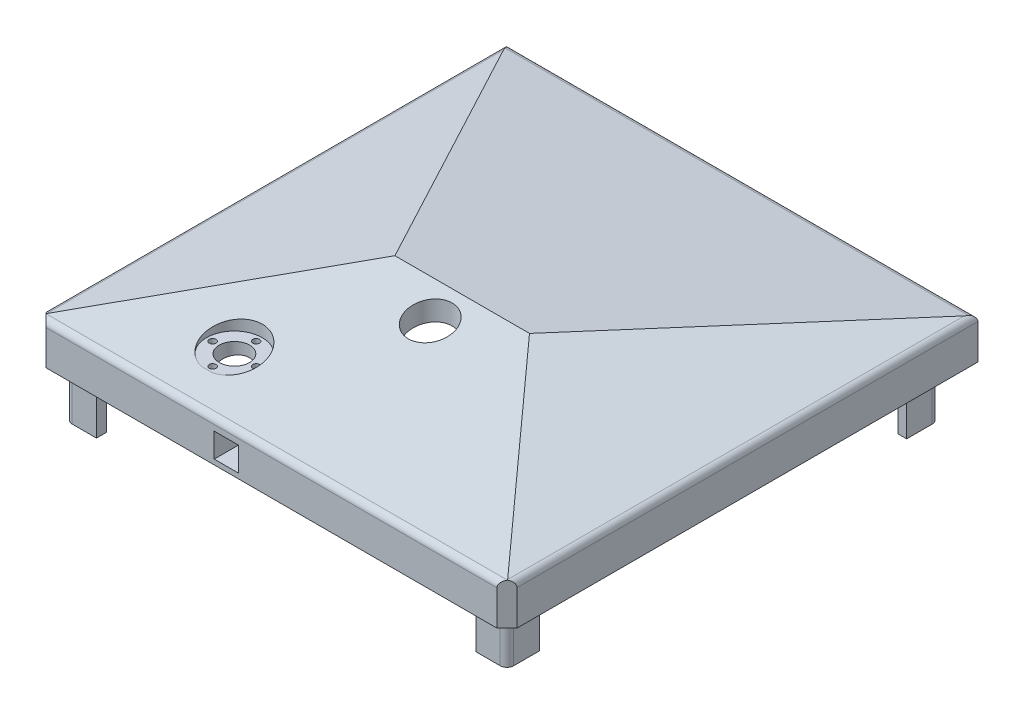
SolidWorks part; units mm, degrees
ref_plane "Front Plane" through (0, 0, 0) normal (0, 0, 1) x (1, 0, 0)
ref_plane "Top Plane" through (0, 0, 0) normal (0, 1, 0) x (1, 0, 0)
ref_plane "Right Plane" through (0, 0, 0) normal (1, 0, 0) x (0, 0, -1)
sketch "Sketch1" plane through (0, 0, 0) normal (0, 0, 1) x (1, 0, 0)
  line L1 (-88.9, 30.48) -> (88.9, 30.48)
  line L2 (-88.9, 30.48) -> (-88.9, 0)
  line L3 (-88.9, 0) -> (88.9, 0)
  line L4 (88.9, 30.48) -> (88.9, 0)
  point P4 (0, 0)
  dimension "D1" = 177.8
  dimension "D2" = 30.48
extrude "Boss-Extrude1" add sketch "Sketch1" against normal blind 177.8
sketch "Sketch2" plane through (0, 0, 0) normal (0, 0, 1) x (1, 0, 0)
  line L1 (-88.9, 15.24) -> (-25.4, 30.48)
  line L2 (88.9, 0) -> (88.9, 30.48) construction
  line L3 (88.9, 15.24) -> (88.9, 30.48)
  line L4 (88.9, 30.48) -> (25.4, 30.48)
  line L5 (0, 0) -> (0, 58.0923) construction
  line L6 (-88.9, 15.24) -> (-88.9, 30.48)
  line L9 (25.4, 30.48) -> (88.9, 15.24)
  line L10 (88.9, 30.48) -> (-88.9, 30.48) construction
  line L11 (-25.4, 30.48) -> (-88.9, 30.48)
  line L12 (-88.9, 30.48) -> (-88.9, 0) construction
  dimension "D1" = 50.8
extrude "Cut-Extrude2" cut sketch "Sketch2" against normal up to surface (177.8 mm away) contours L6 L11 L1 | L4 L9 L3
sketch "Sketch3" plane through (0, 0, 0) normal (1, 0, 0) x (0, 0, -1)
  line L0 (0, 15.24) -> (72.0092, 30.48)
  line L1 (0, 30.48) -> (0, 15.24) construction
  line L2 (72.0092, 30.48) -> (177.8, 15.24)
  line L3 (177.8, 15.24) -> (177.8, 40.9612)
  line L4 (177.8, 40.9612) -> (0, 40.9612)
  line L5 (0, 40.9612) -> (0, 15.24)
  line L6 (177.8, 30.48) -> (0, 30.48) construction
  line L7 (177.8, 15.24) -> (0, 15.24) construction
  dimension "D1" = 72.0092
  dimension "D2" = 25.7212
  dimension "D3" = 177.8
extrude "Cut-Extrude3" cut sketch "Sketch3" against normal up to surface and the other way up to surface
shell "Shell1" thickness 7.366
sketch "Sketch4" plane through (0, 0, 0) normal (0, -1, 0) x (-1, 0, 0)
  line L0 (-78.232, 158.242) -> (-78.232, 166.624)
  line L1 (80.772, 5.588) -> (71.628, 5.588)
  line L2 (83.312, 8.128) -> (83.312, 17.78)
  line L3 (83.312, 17.78) -> (80.01, 17.78)
  line L4 (71.628, 5.588) -> (71.628, 9.398)
  line L5 (-78.994, 7.366) -> (-69.85, 7.366)
  line L6 (-81.534, 9.906) -> (-81.534, 19.558)
  line L7 (-81.534, 19.558) -> (-78.232, 19.558)
  line L8 (-69.85, 7.366) -> (-69.85, 11.176)
  line L9 (-78.994, 170.434) -> (-69.85, 170.434)
  line L10 (-81.534, 167.894) -> (-81.534, 158.242)
  line L11 (-81.534, 158.242) -> (-78.232, 158.242)
  line L12 (-69.85, 170.434) -> (-69.85, 166.624)
  line L13 (78.994, 170.434) -> (69.85, 170.434)
  line L14 (81.534, 167.894) -> (81.534, 158.242)
  line L15 (81.534, 158.242) -> (78.232, 158.242)
  line L16 (69.85, 170.434) -> (69.85, 166.624)
  line L17 (-78.232, 166.624) -> (-69.85, 166.624)
  line L18 (69.85, 166.624) -> (78.232, 166.624)
  line L19 (78.232, 166.624) -> (78.232, 158.242)
  line L20 (80.01, 17.78) -> (80.01, 9.398)
  line L21 (80.01, 9.398) -> (71.628, 9.398)
  line L22 (-78.232, 19.558) -> (-78.232, 11.176)
  line L23 (-78.232, 11.176) -> (-69.85, 11.176)
  arc A0 (-78.994, 7.366) -> (-81.534, 9.906) centre (-78.994, 9.906) cw
  arc A1 (80.772, 5.588) -> (83.312, 8.128) centre (80.772, 8.128) ccw
  arc A2 (81.534, 167.894) -> (78.994, 170.434) centre (78.994, 167.894) ccw
  arc A3 (-78.994, 170.434) -> (-81.534, 167.894) centre (-78.994, 167.894) ccw
  point P30 (-81.534, 7.366)
  point P33 (83.312, 5.588)
  point P36 (81.534, 170.434)
  point P39 (-81.534, 170.434)
  dimension "D13" = 2.54
  dimension "D1" = 12.192
  dimension "D2" = 11.684
  dimension "D3" = 12.192
  dimension "D4" = 11.684
  dimension "D5" = 12.192
  dimension "D6" = 12.192
  dimension "D7" = 11.684
  dimension "D8" = 11.684
  dimension "D9" = 3.81
  dimension "D10" = 3.81
  dimension "D11" = 3.81
  dimension "D12" = 3.81
extrude "Boss-Extrude2" add sketch "Sketch4" along normal blind 19.05 and the other way up to body
ref_plane "Plane1" through (0, 19.05, 0) normal (0, -1, 0) x (-1, 0, 0)
sketch "Sketch5" plane through (0, 19.05, 0) normal (0, -1, 0) x (-1, 0, 0)
  line L0 (88.9, 177.8) -> (-88.9, 177.8) construction
  circle A0 centre (0, 59.9264) radius 8.255
  point P6 (0, 177.8)
  dimension "D2" = 16.51
extrude "Cut-Extrude4" cut sketch "Sketch5" against normal through all both and the other way through all
sketch "Sketch6" plane through (0, 19.05, 0) normal (0, -1, 0) x (-1, 0, 0)
  line L0 (71.628, 9.398) -> (71.628, 5.588) construction
  line L1 (71.628, 7.366) -> (-69.85, 7.366) construction
  circle A0 centre (36.322, 22.352) radius 5.715
  dimension "D1" = 11.43
  dimension "D2" = 35.306
  dimension "D3" = 14.986
extrude "Cut-Extrude5" cut sketch "Sketch6" against normal through all both and the other way through all
ref_plane "Plane2" through (0, 22.86, 0) normal (0, -1, 0) x (-1, 0, 0)
sketch "Sketch7" plane through (0, 22.86, 0) normal (0, -1, 0) x (-1, 0, 0)
  circle A0 centre (36.322, 22.352) radius 10.541
  circle A1 centre (36.322, 22.352) radius 5.715 construction
  dimension "D1" = 21.082
extrude "Cut-Extrude7" cut sketch "Sketch7" along normal blind 5.08
chamfer "Chamfer1" distance 3.81 angle 45 2 edges at (-88.9, 7.62, 0) (88.9, 7.62, 0)
sketch "Sketch8" plane through (0, 0, 0) normal (0, 0, 1) x (1, 0, 0)
  line L1 (-21.59, 11.0473) -> (-12.446, 11.0473)
  line L2 (-21.59, 11.0473) -> (-21.59, 1.9033)
  line L3 (-21.59, 1.9033) -> (-12.446, 1.9033)
  line L4 (-12.446, 11.0473) -> (-12.446, 1.9033)
  line L6 (-85.09, 15.24) -> (-85.09, 0) construction
  dimension "D1" = 9.144
  dimension "D2" = 9.144
  dimension "D4" = 63.5
extrude "Cut-Extrude8" cut sketch "Sketch8" against normal blind 27.78
sketch "Sketch9" plane through (0, 0, -7.366) normal (0, 0, -1) x (-1, 0, 0)
  line L0 (21.59, 9.3669) -> (22.098, 9.3669)
  line L1 (21.59, 11.0473) -> (21.59, 1.9033) construction
  line L2 (22.098, 9.3669) -> (22.098, 11.5553)
  line L3 (22.098, 11.5553) -> (19.9096, 11.5553)
  line L4 (19.9096, 11.5553) -> (19.9096, 11.0473)
  line L5 (12.446, 11.0473) -> (21.59, 11.0473) construction
  line L6 (19.9096, 11.0473) -> (21.59, 11.0473)
  line L7 (21.59, 11.0473) -> (21.59, 9.3669)
  line L8 (17.018, 11.0473) -> (17.018, -1.9929) construction
  line L9 (12.446, 6.4753) -> (5.7248, 6.4753) construction
  line L10 (12.446, 1.9033) -> (12.446, 11.0473) construction
  line L11 (12.446, 9.3669) -> (11.938, 9.3669)
  line L12 (12.446, 11.0473) -> (12.446, 9.3669)
  line L13 (14.1264, 11.5553) -> (14.1264, 11.0473)
  line L14 (14.1264, 11.0473) -> (12.446, 11.0473)
  line L15 (11.938, 11.5553) -> (14.1264, 11.5553)
  line L16 (11.938, 9.3669) -> (11.938, 11.5553)
  line L17 (21.59, 1.9033) -> (21.59, 3.5838)
  line L18 (19.9096, 1.9033) -> (21.59, 1.9033)
  line L19 (19.9096, 1.3953) -> (19.9096, 1.9033)
  line L20 (22.098, 1.3953) -> (19.9096, 1.3953)
  line L21 (22.098, 3.5838) -> (22.098, 1.3953)
  line L22 (21.59, 3.5838) -> (22.098, 3.5838)
  line L23 (11.938, 1.3953) -> (14.1264, 1.3953)
  line L24 (14.1264, 1.9033) -> (12.446, 1.9033)
  line L25 (14.1264, 1.3953) -> (14.1264, 1.9033)
  line L26 (12.446, 1.9033) -> (12.446, 3.5838)
  line L27 (12.446, 3.5838) -> (11.938, 3.5838)
  line L28 (11.938, 3.5838) -> (11.938, 1.3953)
  point P4 (21.844, 9.3669)
  dimension "D1" = 2.1884
  dimension "D2" = 0.508
extrude "Boss-Extrude3" add sketch "Sketch9" along normal blind 3.302
fillet "Fillet1" radius 2.54 4 edges at (0, 15.24, -177.8) (0, 15.24, 0) (88.9, 15.24, -90.805) (-88.9, 15.24, -90.805)
sketch "Sketch10" plane through (0, 17.78, 0) normal (0, 1, 0) x (1, 0, 0)
  circle A0 centre (-44.5344, 22.352) radius 1.27
  circle A1 centre (-36.322, 22.352) radius 8.2124 construction
  circle A2 centre (-36.322, 30.5644) radius 1.27
  circle A3 centre (-28.1096, 22.352) radius 1.27
  circle A4 centre (-36.322, 14.1396) radius 1.27
  circle A6 centre (-36.322, 22.352) radius 10.541 construction
  dimension "D1" = 2.54
  dimension "D2" = 16.4248
extrude "Cut-Extrude9" cut sketch "Sketch10" against normal blind 10.16
sketch "Sketch12" plane through (0, 0, -177.8) normal (0, 0, -1) x (-1, 0, 0)
  line L0 (-57.15, 7.62) -> (-47.752, 7.62) construction
  line L1 (-57.15, 9.271) -> (-47.752, 9.271)
  line L2 (-57.15, 5.969) -> (-47.752, 5.969)
  line L3 (88.9, 0) -> (-88.9, 0) construction
  line L4 (-88.9, 0) -> (-88.9, 13.0397) construction
  line L5 (-6.35, 7.62) -> (3.048, 7.62) construction
  line L6 (-6.35, 9.271) -> (3.048, 9.271)
  line L7 (-6.35, 5.969) -> (3.048, 5.969)
  line L8 (44.45, 7.62) -> (53.848, 7.62) construction
  line L9 (44.45, 9.271) -> (53.848, 9.271)
  line L10 (44.45, 5.969) -> (53.848, 5.969)
  arc A0 (-57.15, 9.271) -> (-57.15, 5.969) centre (-57.15, 7.62) ccw
  arc A1 (-47.752, 5.969) -> (-47.752, 9.271) centre (-47.752, 7.62) ccw
  arc A2 (-6.35, 9.271) -> (-6.35, 5.969) centre (-6.35, 7.62) ccw
  arc A3 (3.048, 5.969) -> (3.048, 9.271) centre (3.048, 7.62) ccw
  arc A4 (44.45, 9.271) -> (44.45, 5.969) centre (44.45, 7.62) ccw
  arc A5 (53.848, 5.969) -> (53.848, 9.271) centre (53.848, 7.62) ccw
  point P2 (-52.451, 7.62)
  point P14 (-1.651, 7.62)
  point P21 (49.149, 7.62)
  dimension "D4" = 31.75
  dimension "D1" = 3.302
  dimension "D2" = 9.398
  dimension "D3" = 7.62
  dimension "D6" = 50.8
  dimension "D5" = 3
extrude "Cut-Extrude10" cut sketch "Sketch12" against normal up to surface (7.366 mm away)
